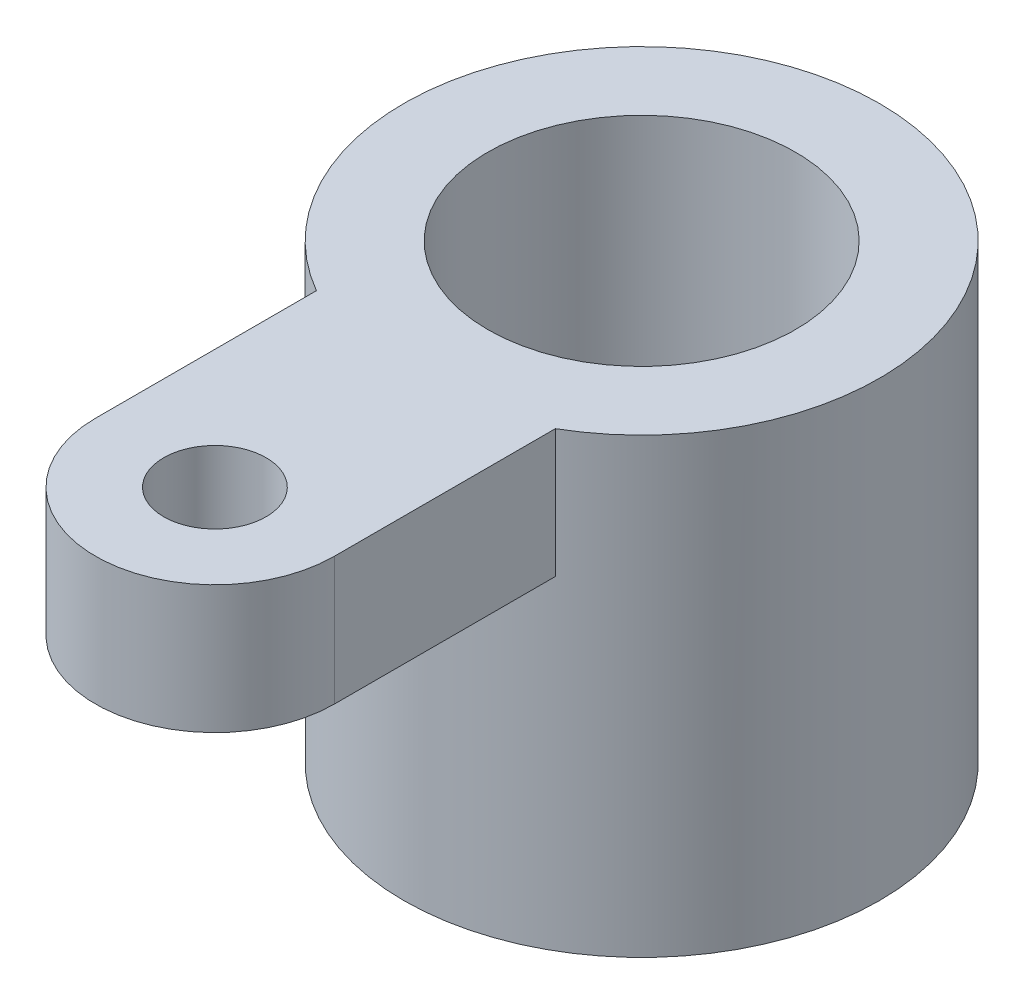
SolidWorks part; units mm, degrees
ref_plane "前视基准面" through (0, 0, 0) normal (0, 0, 1) x (1, 0, 0)
ref_plane "上视基准面" through (0, 0, 0) normal (0, 1, 0) x (1, 0, 0)
ref_plane "右视基准面" through (0, 0, 0) normal (1, 0, 0) x (0, 0, -1)
sketch "草图1" plane through (0, 0, 0) normal (0, 1, 0) x (1, 0, 0)
  line L0 (-44.977, 0) -> (55.9, 0) construction
  line L1 (0, 43.2101) -> (0, -48.6716) construction
  circle A0 centre (0, 0) radius 27.8802
  circle A1 centre (0, 0) radius 18.0231
extrude "凸台-拉伸1" add sketch "草图1" against normal blind 53
sketch "草图2" plane through (0, 0, 0) normal (0, 1, 0) x (1, 0, 0)
  line L0 (0, -73.9139) -> (0, 39.5033) construction
  line L1 (-22.298, -50) -> (30.5566, -50) construction
  line L2 (-14, -50) -> (-14, -24.1103)
  line L3 (14, -50) -> (14, -24.1103)
  circle A0 centre (0, -50) radius 6
  arc A1 (-14, -50) -> (14, -50) centre (0, -50) ccw
  circle A2 centre (0, 0) radius 27.8802 construction
  arc A3 (-14, -24.1103) -> (14, -24.1103) centre (0, 0) ccw
  dimension "D1" = 28
  dimension "D2" = 12
  dimension "D3" = 50
extrude "凸台-拉伸2" add sketch "草图2" against normal blind 15
